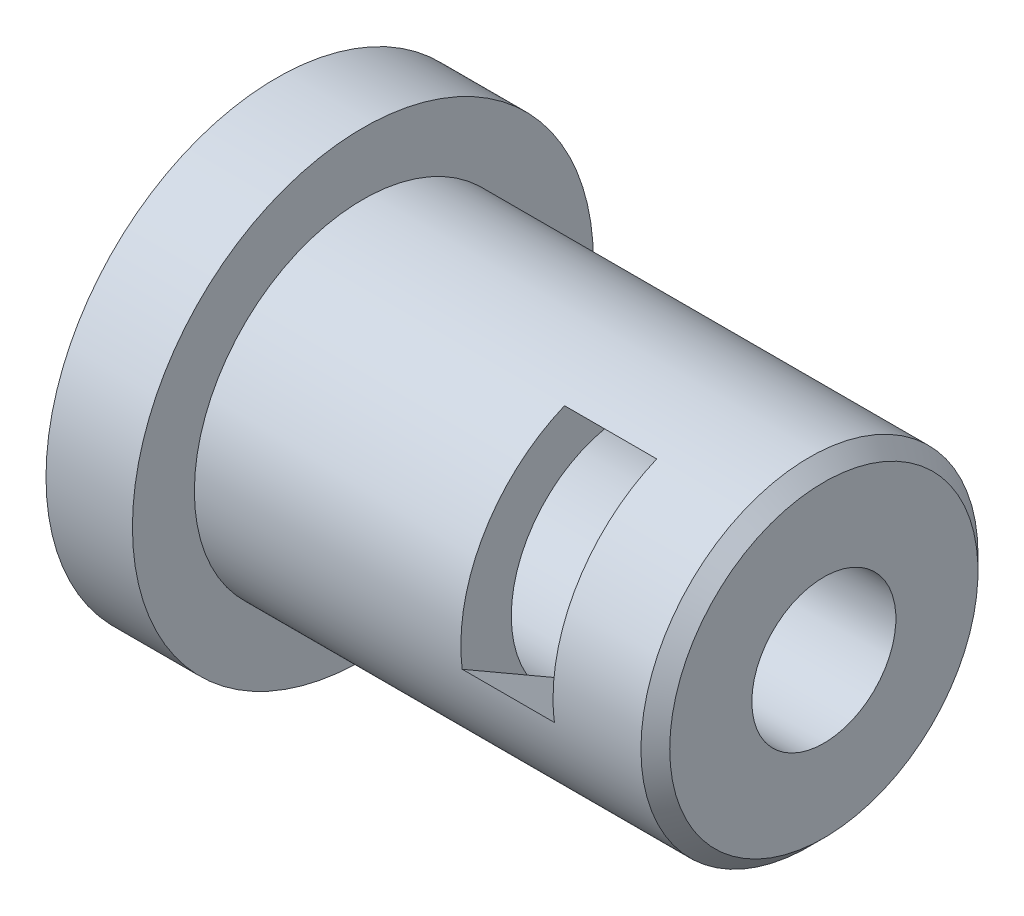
SolidWorks part; units mm, degrees
ref_plane "Plan de face" through (0, 0, 0) normal (0, 0, 1) x (1, 0, 0)
ref_plane "Plan de dessus" through (0, 0, 0) normal (0, 1, 0) x (1, 0, 0)
ref_plane "Plan de droite" through (0, 0, 0) normal (1, 0, 0) x (0, 0, -1)
sketch "Esquisse1" plane through (0, 0, 0) normal (0, 0, 1) x (1, 0, 0)
  line L0 (0, 4.1) -> (0, 8)
  line L1 (0, 8) -> (3, 8)
  line L4 (19, 5.85) -> (19, 2.5)
  line L5 (19, 2.5) -> (12.25, 2.5)
  line L6 (12.25, 2.5) -> (12.25, 4.1)
  line L7 (12.25, 4.1) -> (0, 4.1)
  line L8 (3, 8) -> (3, 5.85)
  line L9 (3, 5.85) -> (19, 5.85)
  line L10 (-9.4106, 0) -> (27.5485, 0) construction
  point P5 (3, 6.925)
  dimension "D1" = 4.1
  dimension "D2" = 8
  dimension "D3" = 5.85
  dimension "D4" = 16
  dimension "D5" = 6.75
  dimension "D6" = 3
  dimension "D7" = 2.5
revolve "Révolution1" add sketch "Esquisse1" angle 360 about L10
chamfer "Chanfrein3" distance 0.5 angle 45 2 edges at (19, 0, 5.85) (0, 0, 4.1)
sketch "Esquisse2" plane through (0, 0, 0) normal (-1, 0, 0) x (0, 0, 1)
  line L1 (3.55, -2.0496) -> (3.55, 2.0496)
  line L2 (3.55, 2.0496) -> (0, 4.0992)
  line L3 (0, 4.0992) -> (-3.55, 2.0496)
  line L4 (-3.55, 2.0496) -> (-3.55, -2.0496)
  line L5 (-3.55, -2.0496) -> (0, -4.0992)
  line L6 (0, -4.0992) -> (3.55, -2.0496)
  circle A0 centre (0, 0) radius 3.55 construction
  dimension "D1" = 7.1
extrude "Enlèv. mat.-Extru.2" cut sketch "Esquisse2" against normal blind 3.2 from offset 12.25
ref_plane "Support lumière" through (0, 0, 0) normal (0, -0.5, -0.866) x (-1, 0, 0)
sketch "Esquisse4" plane through (0, 0, 0) normal (0, -0.5, -0.866) x (-1, 0, 0)
  line L1 (-12.25, 3.55) -> (-15.45, 3.55)
  line L2 (-12.25, 3.55) -> (-12.25, -3.55)
  line L3 (-12.25, -3.55) -> (-15.45, -3.55)
  line L4 (-15.45, 3.55) -> (-15.45, -3.55)
  line L5 (-15.45, -3.55) -> (-15.45, 0) construction
  line L6 (-15.45, 3.55) -> (-12.25, 3.55) construction
  line L7 (-15.45, -3.55) -> (-12.25, -3.55) construction
  dimension "D2" = 3.2
extrude "Enlèv. mat.-Extru.4" cut sketch "Esquisse4" against normal through all
